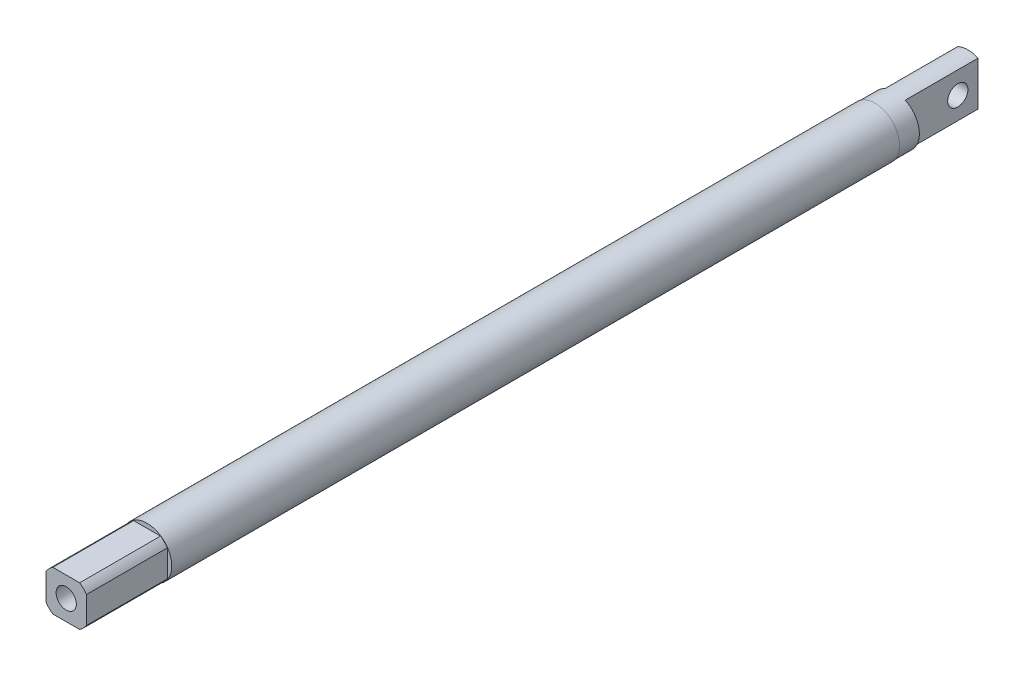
SolidWorks part; units mm, degrees
other "<Left_Cylinder>-<Split Line1>"
ref_plane "Front Plane" through (0, 0, 0) normal (0, 0, 1) x (1, 0, 0)
ref_plane "Top Plane" through (0, 0, 0) normal (0, 1, 0) x (1, 0, 0)
ref_plane "Right Plane" through (0, 0, 0) normal (1, 0, 0) x (0, 0, -1)
mirrored part "Left_Cylinder_Mirrored"
sketch3d "3DSketch1"
  circle A1 centre (3.175, 0, -1437.1664) radius 3.175 construction
  circle A2 centre (-3.175, 0, -1437.1664) radius 3.175 construction
  point P0 (3.175, 0, -1437.1664)
  point P1 (-3.175, 0, -1437.1664)
  point P4 (6.35, 0, -1437.1664)
  point P7 (0, 0, -1437.1664)
ref_point "Point1"
sketch "Sketch1" plane through (0, 0, -1185.7064) normal (0, 0, 1) x (1, 0, 0)
  circle A0 centre (0, 0) radius 8.3388
extrude "Cut-Extrude1" cut sketch "Sketch1" against normal up to surface (228.6 mm away)
sketch "Sketch2" plane through (0, 0, -1185.7064) normal (0, 0, -1) x (-1, 0, 0)
  circle A0 centre (0, 0) radius 7.747
  circle A1 centre (0, 0) radius 6.223
  dimension "D1" = 12.446
  dimension "D2" = 1.524
extrude "Extrude1" add sketch "Sketch2" along normal up to surface (228.6 mm away)
sketch "Sketch3" [suppressed] plane through (0, 0, -1414.3064) normal (0, 0, 1) x (1, 0, 0)
  point P0 (0, 0)
